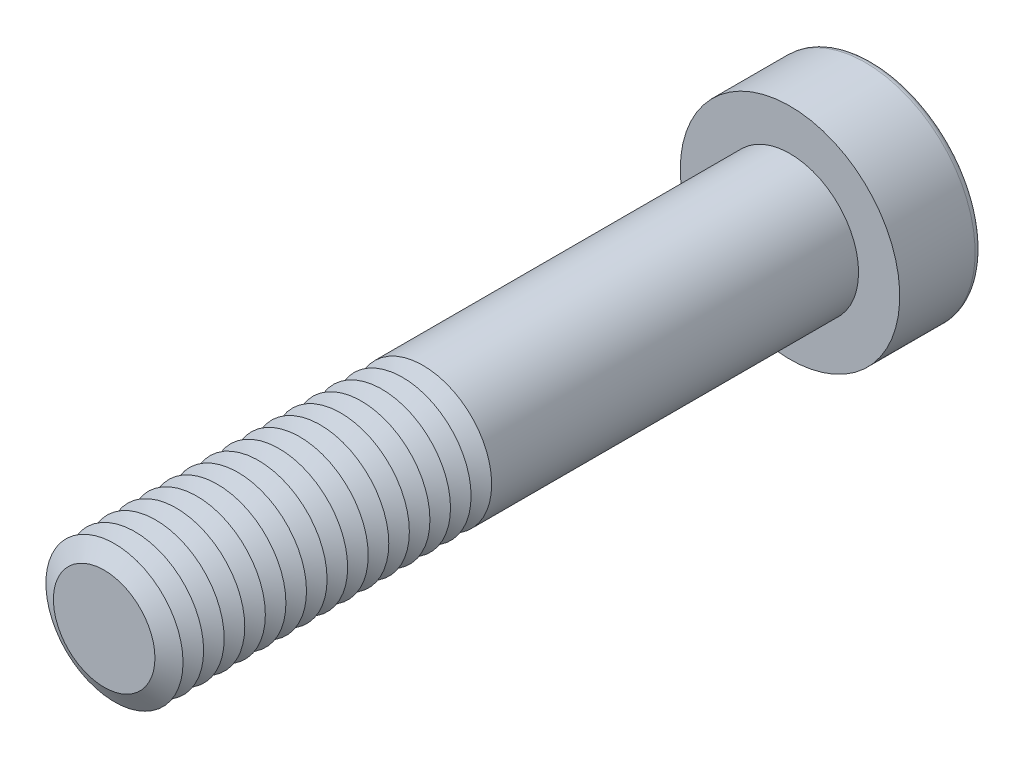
SolidWorks part; units mm, degrees
ref_plane "Front Plane" through (0, 0, 0) normal (0, 0, 1) x (1, 0, 0)
ref_plane "Top Plane" through (0, 0, 0) normal (0, 1, 0) x (1, 0, 0)
ref_plane "Right Plane" through (0, 0, 0) normal (1, 0, 0) x (0, 0, -1)
sketch "Sketch1" plane through (0, 0, 0) normal (0, 0, 1) x (1, 0, 0)
  circle A0 centre (0, 0) radius 5
  dimension "D1" = 10
extrude "Boss-Extrude1" add sketch "Sketch1" along normal blind 50
sketch "Sketch2" plane through (0, 0, 0) normal (0, 0, -1) x (-1, 0, 0)
  circle A0 centre (0, 0) radius 8
  dimension "D1" = 16
extrude "Boss-Extrude2" add sketch "Sketch2" along normal blind 6
sketch "Sketch3" plane through (0, 0, -6) normal (0, 0, -1) x (-1, 0, 0)
  line L1 (-2.0207, 3.5) -> (-4.0415, 0)
  line L2 (-4.0415, 0) -> (-2.0207, -3.5)
  line L3 (-2.0207, -3.5) -> (2.0207, -3.5)
  line L4 (2.0207, -3.5) -> (4.0415, 0)
  line L5 (4.0415, 0) -> (2.0207, 3.5)
  line L6 (2.0207, 3.5) -> (-2.0207, 3.5)
  circle A0 centre (0, 0) radius 3.5 construction
  dimension "D1" = 7
extrude "Cut-Extrude1" cut sketch "Sketch3" against normal blind 5.25
fillet "Fillet1" radius 0.5 1 edges at (-8, 0, -6)
sketch "Sketch4" plane through (0, 0, -0.75) normal (0, 0, -1) x (-1, 0, 0)
  line L0 (2.0207, -3.5) -> (4.0415, 0) construction
  circle A0 centre (0, 0) radius 3.5
extrude "Cut-Extrude2" cut sketch "Sketch4" against normal through all draft 60
sketch "Sketch5" plane through (0, 0, -6) normal (0, 0, -1) x (-1, 0, 0)
  circle A0 centre (0, 0) radius 4.0415
extrude "Cut-Extrude3" cut sketch "Sketch5" against normal through all draft 75
sketch "Sketch7" plane through (0, 0, 0) normal (1, 0, 0) x (0, 0, -1)
  line L25 (-50, 3.701) -> (-49.25, 5)
  line L26 (-50, 5) -> (-50, -5) construction
  line L27 (-49.25, 5) -> (-50.75, 5)
  line L28 (-50.75, 5) -> (-50, 3.701)
  line L29 (0, 5) -> (-50, 5) construction
  dimension "D1" = 1.5
revolve "Cut-Revolve1" cut sketch "Sketch7" angle 360 about axis through (0, 0, 50) along (0, 0, -1)
pattern_linear "LPattern1" count 16 spacing 1.5 along (0, 0, -1) of "Cut-Revolve1"
